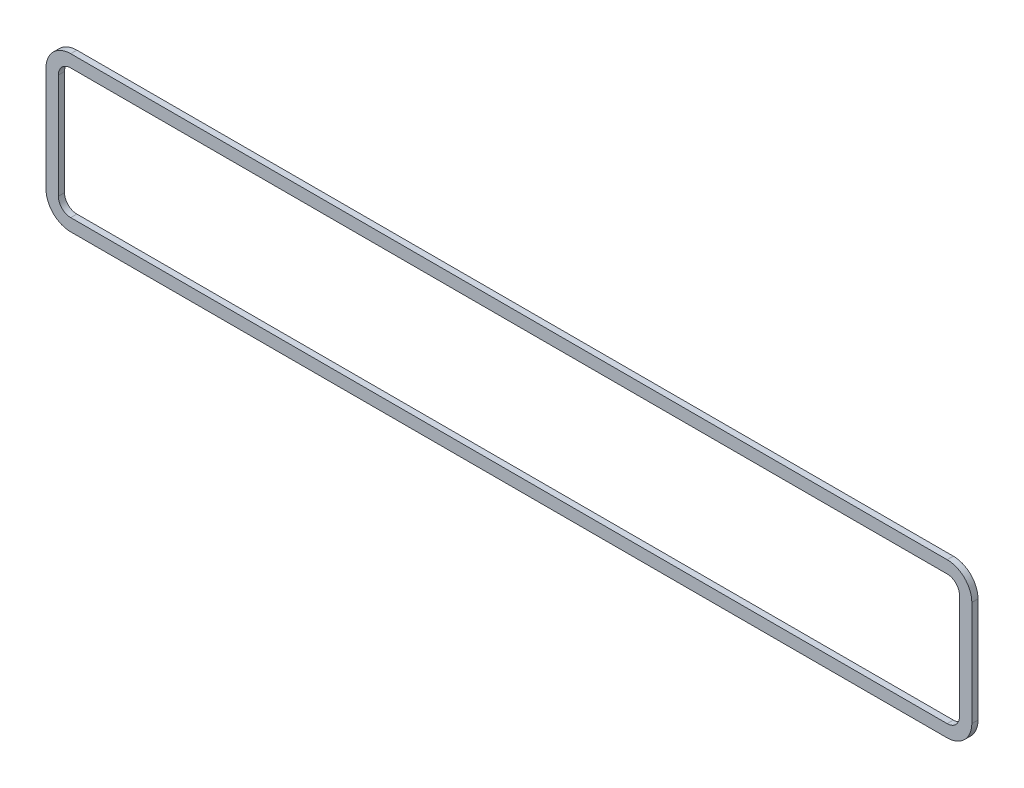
SolidWorks part; units mm, degrees
ref_plane "Front Plane" through (0, 0, 0) normal (0, 0, 1) x (1, 0, 0)
ref_plane "Top Plane" through (0, 0, 0) normal (0, 1, 0) x (1, 0, 0)
ref_plane "Right Plane" through (0, 0, 0) normal (1, 0, 0) x (0, 0, -1)
sketch "Skizze5" plane through (0, 0, 0) normal (0, 0, 1) x (1, 0, 0)
  line L0 (-37.5, -8) -> (-37.5, 0.5) construction
  line L1 (37.5, 0.5) -> (37.5, -8)
  line L2 (-35.5, 1.5) -> (35.5, 1.5)
  line L3 (36.5, 0.5) -> (36.5, -8)
  line L4 (-35.5, -9) -> (35.5, -9)
  line L5 (-35.5, 2.5) -> (35.5, 2.5)
  line L6 (-36.5, 0.5) -> (-36.5, -8)
  line L7 (37.5, 0.5) -> (37.5, -8) construction
  line L8 (-35.5, -10) -> (35.5, -10)
  line L10 (35.5, -10) -> (-35.5, -10) construction
  line L11 (-37.5, 0.5) -> (-37.5, -8)
  arc A0 (35.5, 2.5) -> (37.5, 0.5) centre (35.5, 0.5) cw
  arc A1 (35.5, 2.5) -> (37.5, 0.5) centre (35.5, 0.5) ccw construction
  arc A2 (37.5, -8) -> (35.5, -10) centre (35.5, -8) cw
  arc A3 (37.5, -8) -> (35.5, -10) centre (35.5, -8) ccw construction
  arc A4 (-37.5, 0.5) -> (-35.5, 2.5) centre (-35.5, 0.5) cw
  arc A5 (-37.5, -8) -> (-35.5, -10) centre (-35.5, -8) ccw
  arc A6 (35.5, 1.5) -> (36.5, 0.5) centre (35.5, 0.5) cw
  arc A7 (36.5, -8) -> (35.5, -9) centre (35.5, -8) cw
  arc A8 (-36.5, -8) -> (-35.5, -9) centre (-35.5, -8) ccw
  arc A9 (-36.5, 0.5) -> (-35.5, 1.5) centre (-35.5, 0.5) cw
  dimension "D1" = 2
  dimension "D2" = 2
extrude "Linear austragen1" add sketch "Skizze5" against normal blind 0.5
